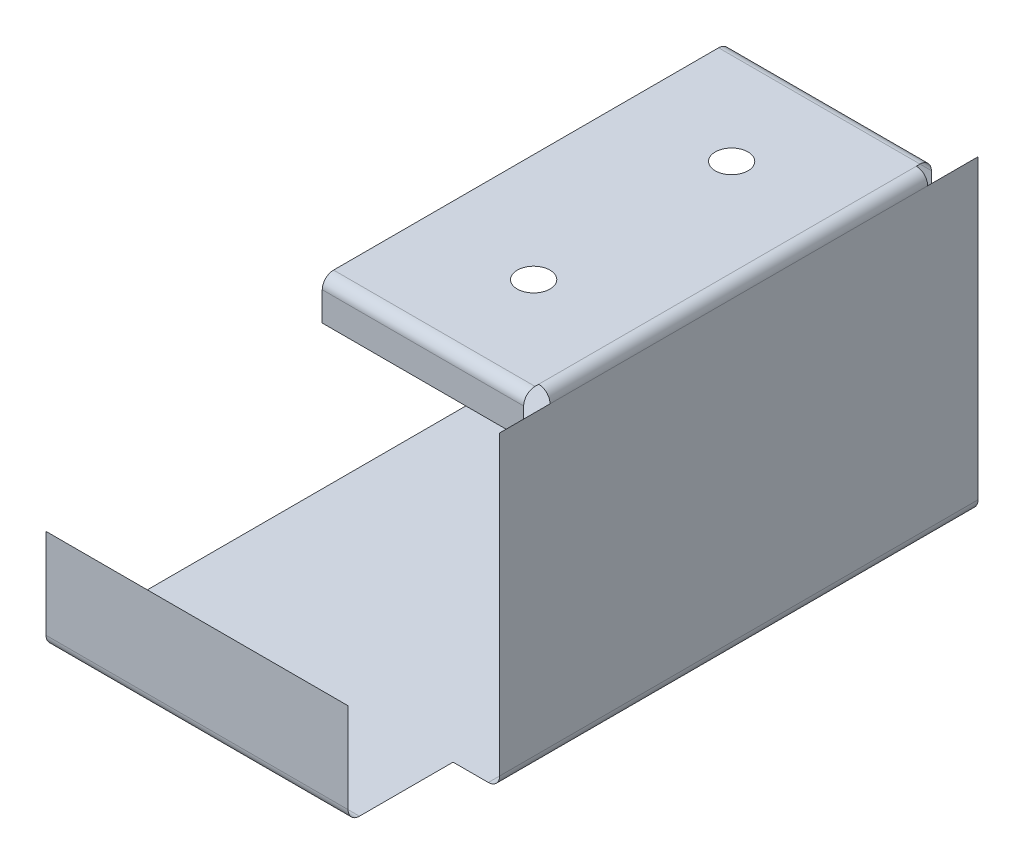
SolidWorks part; units mm, degrees
ref_plane "Plane1" through (0, 0, 0) normal (0, 0, 1) x (1, 0, 0)
ref_plane "Plane2" through (0, 0, 0) normal (0, 1, 0) x (1, 0, 0)
ref_plane "Plane3" through (0, 0, 0) normal (1, 0, 0) x (0, 0, -1)
other "Configuration Table"
sketch "Sketch1" plane through (0, 0, 0) normal (0, 0, 1) x (1, 0, 0)
  line L0 (-1095.1732, 1618.0661) -> (-2.9732, 1618.0661)
  line L1 (-2.9732, 1618.0661) -> (-2.9732, -32.9339)
  line L2 (-2.9732, -32.9339) -> (-1780.9732, -32.9339)
  dimension "D1" = 1778
  dimension "D2" = 1651
  dimension "D3" = 1092.2
extrude "Base-Extrude-Thin" add sketch "Sketch1" along normal blind 2413 thin
sheet metal parameters "Sheet-Metal1" parameters "D1"=38.1
bend "SharpBend2" parameters "D1"=0, "D2"=1
flatten bends "Flatten-Bends1"
bend "SharpBend1" parameters "D1"=0, "D2"=2
sketch "Sharp-Round-Sketch1" plane through (0, 5.1661, 0) normal (0, 1, 0) x (-1, 0, 0)
  line L0 (34.2877, 2413) -> (34.2877, 0) construction
  line L1 (-1554.0833, 2413) -> (-1554.0833, 0) construction
  dimension "D1" = 0
sketch "Sketch4" plane through (0, 5.1661, 0) normal (0, 1, 0) x (-1, 0, 0)
  line L0 (1780.9732, 2413) -> (256.9732, 2413)
  line L1 (79.1732, 2413) -> (1780.9732, 2413) construction
  line L2 (256.9732, 2413) -> (256.9732, 3429)
  line L3 (1780.9732, 2413) -> (1780.9732, 3429)
  line L5 (699.5351, 4046.8978) -> (697.3368, 4046.8978) construction
  line L7 (256.9732, 3429) -> (1780.9732, 3429)
  dimension "D1" = 1016
  dimension "D2" = 1524
extrude "Boss-Extrude2" add sketch "Sketch4" against normal through all
sketch "Sketch6" plane through (0, 5.1661, 0) normal (0, 1, 0) x (-1, 0, 0)
  line L0 (-1598.9688, 0) -> (-1598.9688, 254)
  line L1 (-1598.9688, 2413) -> (-1598.9688, 0) construction
  line L2 (-1509.1978, 0) -> (-1509.1978, 254)
  line L3 (-1509.1978, 2413) -> (-1509.1978, 0) construction
  line L4 (-1509.1978, 0) -> (-1598.9688, 0)
  line L5 (-1509.1978, 254) -> (-1598.9688, 254)
  line L6 (-1509.1978, 2413) -> (-1509.1978, 2159)
  line L7 (-1598.9688, 2413) -> (-1598.9688, 2159)
  line L8 (-1598.9688, 2159) -> (-1509.1978, 2159)
  line L9 (-1509.1978, 2413) -> (-1598.9688, 2413)
  dimension "D1" = 254
  dimension "D2" = 254
extrude "Cut-Extrude2" cut sketch "Sketch6" against normal through all
sketch "Sketch7" plane through (0, 5.1661, 0) normal (0, 1, 0) x (-1, 0, 0)
  line L0 (-2614.9688, 2413) -> (-2614.9688, 0) construction
  line L1 (-2614.9688, 2413) -> (-1598.9688, 2413) construction
  circle A0 centre (-2085.8859, 698.6425) radius 82.55
  circle A1 centre (-2068.8688, 1714.5) radius 82.55
  dimension "D2" = 165.1
  dimension "D3" = 165.1
  dimension "D1" = 1016
  dimension "D4" = 546.1
  dimension "D5" = 698.5
extrude "Cut-Extrude3" cut sketch "Sketch7" against normal through all
process bends "Process-Bends1" parameters "D1"=0
sketch "Flat-Sketch1" plane through (0, 5.1661, 0) normal (0, 1, 0) x (-1, 0, 0)
  line L0 (2105.6511, 2930.216) -> (195.6117, 2930.216) construction
  line L1 (-2614.9688, 190.5) -> (-1598.9688, 190.5)
  line L2 (-2614.9688, 190.5) -> (-1598.9688, 190.5) construction
  line L3 (-2614.9688, 2222.5) -> (-1598.9688, 2222.5)
  line L4 (-2614.9688, 2222.5) -> (-1598.9688, 2222.5) construction
  dimension "D1" = 190.5
  dimension "D2" = 190.5
bend "FlatBend1" bend radius 38.1
bend "FlatBend2" parameters "D1"=0, "D2"=5
bend "FlatBend3" parameters "D1"=0, "D2"=3
scale "Scale1" scale about centroid uniform scaling yes scale factor 0.1
surface "Surface-MidSurface2" parameters "D0"=50000, "D1"=50000, "D2"=50000, "D3"=50000, "D4"=50000, "D5"=50000, "D6"=50000, "D7"=50000, "D8"=50000, "D9"=50000, "D10"=50000
delete or keep bodies "Body-Delete" type delete bodies bodies 106
